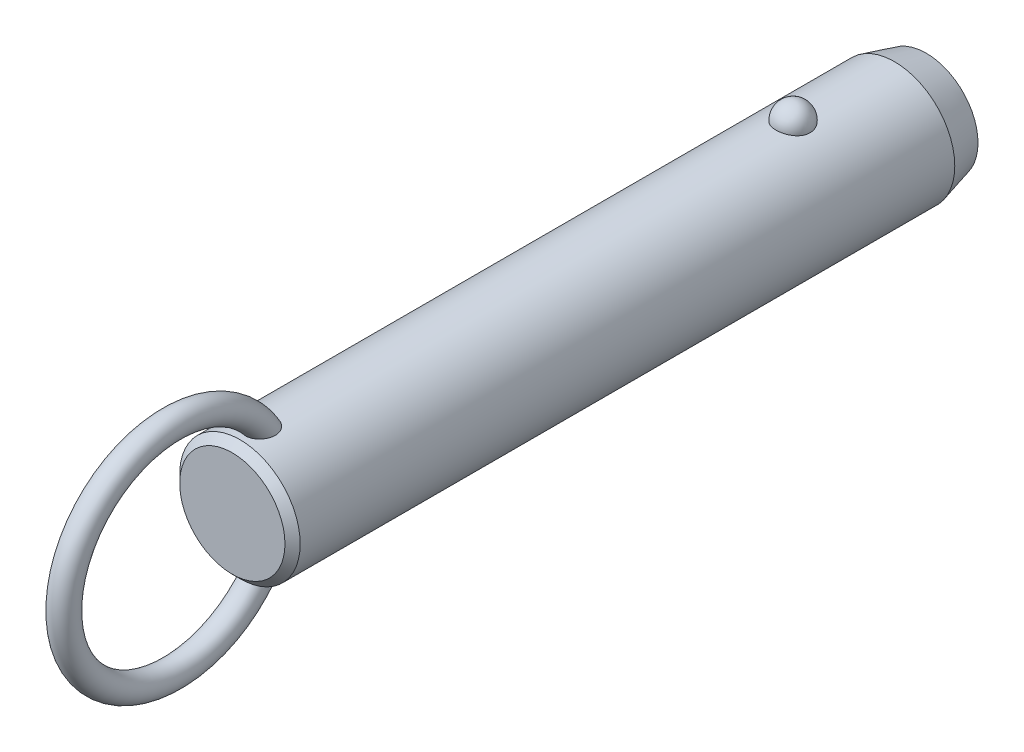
SolidWorks part; units mm, degrees
ref_plane "Front Plane" through (0, 0, 0) normal (0, 0, 1) x (1, 0, 0)
ref_plane "Top Plane" through (0, 0, 0) normal (0, 1, 0) x (1, 0, 0)
ref_plane "Right Plane" through (0, 0, 0) normal (1, 0, 0) x (0, 0, -1)
sketch "Sketch2" plane through (0, 0, 0) normal (0, 0, 1) x (1, 0, 0)
  circle A0 centre (0, 0) radius 9.5
  point P3 (0, 9.5)
  dimension "D1" = 19
extrude "Boss-Extrude1" add sketch "Sketch2" along normal blind 76.2
sketch "Sketch3" plane through (0, 0, 0) normal (0, 0, -1) x (-1, 0, 0)
  circle A0 centre (0, 0) radius 9.5
  dimension "D1" = 19
extrude "Boss-Extrude2" add sketch "Sketch3" along normal blind 23.7
chamfer "Chamfer1" distance 5 angle 15 1 edges at (-9.5, 0, -23.7)
sketch "Sketch12" plane through (0, 0, 0) normal (1, 0, 0) x (0, 0, -1)
  line L0 (-76.2, 9.5) -> (-76.2, -9.5) construction
  point P0 (-76.2, 0)
sketch "Sketch13" plane through (0, 0, 0) normal (1, 0, 0) x (0, 0, -1)
  circle A0 centre (-95.25, 0) radius 19.05
  point P2 (-76.2, 0)
  dimension "D1" = 38.1
sketch "Sketch14" plane through (0, 0, 0) normal (0, 1, 0) x (1, 0, 0)
  circle A0 centre (0, -78.2) radius 2
  point P2 (0, -76.2)
  dimension "D1" = 4
sweep "Sweep1" add profiles "Sketch14" path "Sketch13"
sketch "Sketch15" plane through (0, 0, 76.2) normal (0, 0, 1) x (1, 0, 0)
  circle A0 centre (0, 0) radius 9.5
  dimension "D1" = 19
extrude "Boss-Extrude3" add sketch "Sketch15" along normal blind 9.52
chamfer "Chamfer2" distance 1.2 angle 45 1 edges at (9.5, 0, 85.72)
sketch "Sketch18" plane through (0, 0, 0) normal (1, 0, 0) x (0, 0, -1)
  line L0 (18.7, 9.5) -> (-78.7378, 9.5) construction
  line L1 (2.7, 12.2) -> (2.7, 6.8)
  line L2 (-78.7378, -9.5) -> (18.7, -9.5) construction
  arc A0 (2.7, 12.2) -> (2.7, 6.8) centre (2.7, 9.5) ccw
  point P4 (0, 9.5)
  dimension "D1" = 21.7
revolve "Revolve1" add sketch "Sketch18" angle 360 about L1
